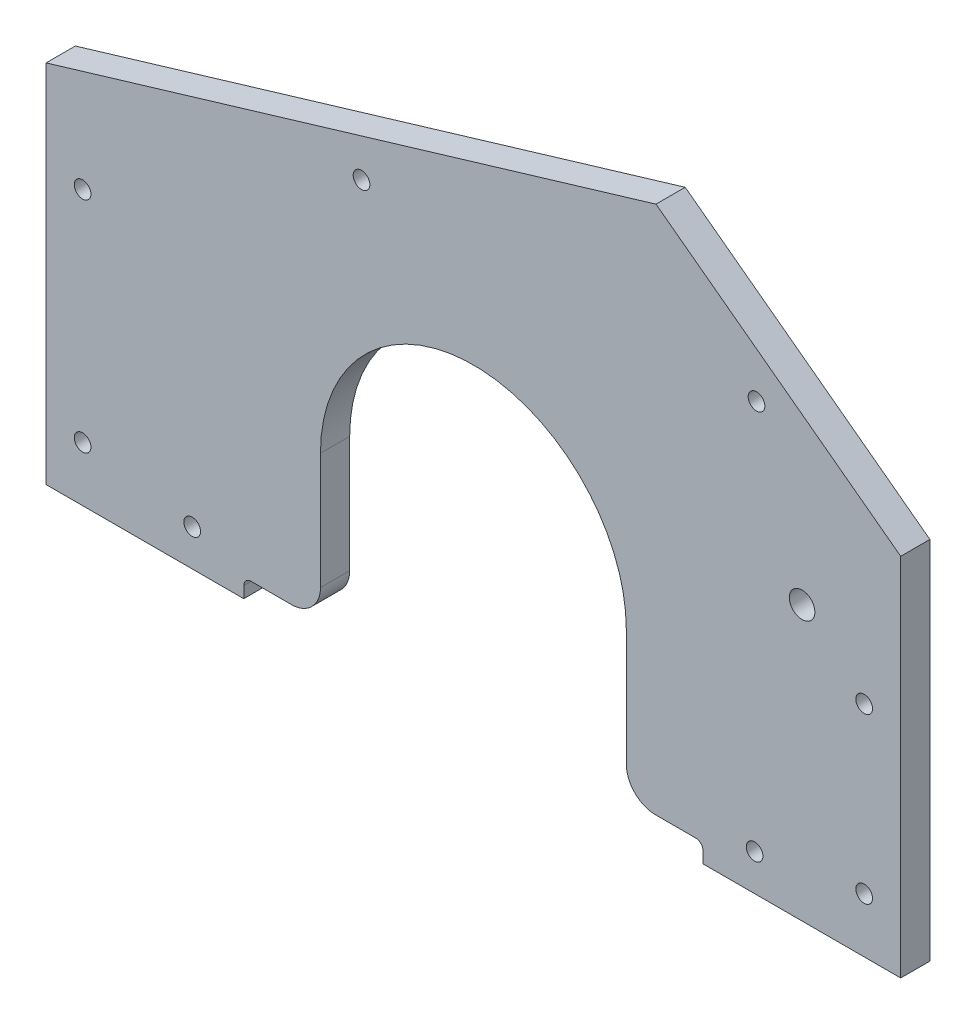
SolidWorks part; units mm, degrees
ref_plane "Front Plane" through (0, 0, 0) normal (0, 0, 1) x (1, 0, 0)
ref_plane "Top Plane" through (0, 0, 0) normal (0, 1, 0) x (1, 0, 0)
ref_plane "Right Plane" through (0, 0, 0) normal (1, 0, 0) x (0, 0, -1)
sketch "Sketch1" plane through (0, 0, 0) normal (0, 0, 1) x (1, 0, 0)
  line L0 (-135.2066, -69.6735) -> (-135.2066, 30.3265)
  line L1 (-135.2066, 30.3265) -> (31.7934, 80.3265)
  line L2 (31.7934, 80.3265) -> (98.7934, 30.3265)
  line L3 (98.7934, 30.3265) -> (98.7934, -69.6735)
  line L4 (98.7934, -69.6735) -> (-135.2066, -69.6735)
  line L5 (31.7934, 80.3265) -> (31.7934, -69.6735) construction
  line L6 (-135.2066, -59.6735) -> (98.7934, -59.6735) construction
  line L7 (-125.2066, 33.3205) -> (-125.2066, -69.6735) construction
  line L8 (-135.2066, 19.8879) -> (41.7761, 72.8768) construction
  line L9 (19.8607, 76.7539) -> (98.7934, 17.8489) construction
  line L10 (88.7934, 37.7892) -> (88.7934, -69.6735) construction
  line L11 (-18.2066, -69.6735) -> (-18.2066, 65.3565) construction
  line L12 (-135.2066, -24.6735) -> (98.7934, -24.6735) construction
  line L13 (-135.2066, 5.3265) -> (98.7934, 5.3265) construction
  line L14 (71.7934, 50.4758) -> (71.7934, -69.6735) construction
  line L15 (65.2934, 55.3265) -> (42.5646, 24.8699) construction
  line L16 (-51.7066, 55.3265) -> (-39.6605, 15.0927) construction
  line L17 (-95.2066, -69.6735) -> (-95.2066, -51.1874) construction
  line L18 (-135.2066, 5.3265) -> (-112.0673, 5.3265) construction
  line L19 (98.7934, -9.6735) -> (76.9523, -9.6735) construction
  circle A0 centre (-125.2066, 5.3265) radius 2.285
  circle A2 centre (-95.2066, -59.6735) radius 2.285
  circle A7 centre (59.3125, 47.3122) radius 2.285
  circle A8 centre (71.7934, 5.3265) radius 7.7375 construction
  circle A9 centre (-48.8384, 45.7467) radius 2.285
  circle A10 centre (58.7934, -59.6735) radius 2.285
  circle A11 centre (-125.2066, -54.6735) radius 2.285
  circle A12 centre (88.7934, -54.6735) radius 2.285
  circle A14 centre (88.7934, -9.6735) radius 2.285
  point P28 (-48.8384, 45.7467)
  point P30 (59.3125, 47.3122)
  point P31 (71.7934, 5.3265)
  point P51 (88.7934, -9.6735)
  point P54 (0, 0)
  dimension "D11" = 4.57
  dimension "D12" = 15
  dimension "D13" = 4.57
  dimension "D14" = 25
  dimension "D15" = 4.57
  dimension "D16" = 4.57
  dimension "D18" = 4.57
  dimension "D22" = 15.475
  dimension "D1" = 234
  dimension "D2" = 100
  dimension "D3" = 100
  dimension "D4" = 50
  dimension "D5" = 67
  dimension "D6" = 10
  dimension "D7" = 10
  dimension "D8" = 10
  dimension "D9" = 10
  dimension "D10" = 10
  dimension "D19" = 45
  dimension "D20" = 30
  dimension "D21" = 90
  dimension "D23" = 40
extrude "Boss-Extrude1" add sketch "Sketch1" against normal blind 8
sketch "Sketch2" plane through (0, 0, 0) normal (0, 0, 1) x (1, 0, 0)
  line L0 (-135.2066, 5.3265) -> (98.7934, 5.3265) construction
  line L1 (71.7934, 50.4758) -> (71.7934, -69.6735) construction
  line L2 (-135.2066, 5.3265) -> (98.7934, 5.3265) construction
  line L3 (71.7934, 50.4758) -> (71.7934, -69.6735) construction
  circle A0 centre (71.7934, 5.3265) radius 7.7375 construction
  circle A1 centre (71.7934, 5.3265) radius 7.7375 construction
  circle A2 centre (71.7934, 5.3265) radius 15
  dimension "D1" = 30
extrude "Boss-Extrude2" add sketch "Sketch2" against normal blind 15
sketch "Sketch3" plane through (0, 0, 0) normal (0, 0, 1) x (1, 0, 0)
  line L0 (98.7934, -69.6735) -> (-135.2066, -69.6735) construction
  line L1 (-135.2066, -24.6735) -> (98.7934, -24.6735) construction
  line L2 (-18.2066, -69.6735) -> (-18.2066, 65.3565) construction
  line L3 (98.7934, -69.6735) -> (-135.2066, -69.6735) construction
  line L4 (-135.2066, -24.6735) -> (98.7934, -24.6735) construction
  line L5 (-18.2066, -69.6735) -> (-18.2066, 65.3565) construction
  line L6 (23.6684, -24.6735) -> (23.6684, -69.6735) construction
  line L7 (-60.0816, -24.6735) -> (-60.0816, -69.6735) construction
  line L8 (-81.0816, -66.5485) -> (44.6684, -66.5485) construction
  line L9 (-81.0816, -69.6735) -> (-81.0816, -66.5485) construction
  line L10 (44.6684, -69.6735) -> (44.6684, -66.5485) construction
  line L11 (-81.0816, -64.5435) -> (44.6684, -64.5435) construction
  line L13 (44.6684, -69.6735) -> (44.6684, -64.5435)
  line L14 (44.6684, -64.5435) -> (23.6684, -64.5435)
  line L15 (23.6684, -64.5435) -> (23.6684, -24.6735)
  line L16 (-81.0816, -69.6735) -> (-81.0816, -64.5435)
  line L17 (-81.0816, -64.5435) -> (-60.0816, -64.5435)
  line L18 (-60.0816, -64.5435) -> (-60.0816, -24.6735)
  line L19 (-81.0816, -69.6735) -> (-81.0816, -72.3335)
  line L20 (-81.0816, -72.3335) -> (44.6684, -72.3335)
  line L21 (44.6684, -72.3335) -> (44.6684, -69.6735)
  line L22 (-135.2066, 5.3265) -> (98.7934, 5.3265) construction
  line L23 (71.7934, 50.4758) -> (71.7934, -69.6735) construction
  line L24 (-135.2066, 5.3265) -> (98.7934, 5.3265) construction
  line L25 (71.7934, 50.4758) -> (71.7934, -69.6735) construction
  circle A0 centre (-18.2066, -24.6735) radius 41.875 construction
  arc A1 (-60.0816, -24.6735) -> (23.6684, -24.6735) centre (-18.2066, -24.6735) cw
  circle A2 centre (71.7934, 5.3265) radius 3.5
  point P16 (-18.2066, -66.5485)
  dimension "D1" = 83.75
  dimension "D5" = 7
  dimension "D2" = 62.875
  dimension "D3" = 5.13
  dimension "D4" = 2.66
extrude "Cut-Extrude1" cut sketch "Sketch3" against normal blind 18 and the other way blind 2
sketch "Sketch4" plane through (0, 0, 0) normal (0, 0, 1) x (1, 0, 0)
  line L0 (-135.2066, 5.3265) -> (98.7934, 5.3265) construction
  line L1 (71.7934, 50.4758) -> (71.7934, -69.6735) construction
  line L2 (-135.2066, 5.3265) -> (98.7934, 5.3265) construction
  line L3 (71.7934, 50.4758) -> (71.7934, -69.6735) construction
  circle A0 centre (71.7934, 5.3265) radius 7.7375 construction
  circle A1 centre (71.7934, 5.3265) radius 7.7375
extrude "Cut-Extrude2" cut sketch "Sketch4" against normal blind 6 from offset 10.222
fillet "Fillet1" radius 8 2 edges at (-60.0816, -64.5435, -4) (23.6684, -64.5435, -4)
fillet "Fillet2" radius 2 2 edges at (-81.0816, -64.5435, -4) (44.6684, -64.5435, -4)
chamfer "Chamfer1" distance 2 angle 45 1 edges at (56.7934, 5.3265, -8)
